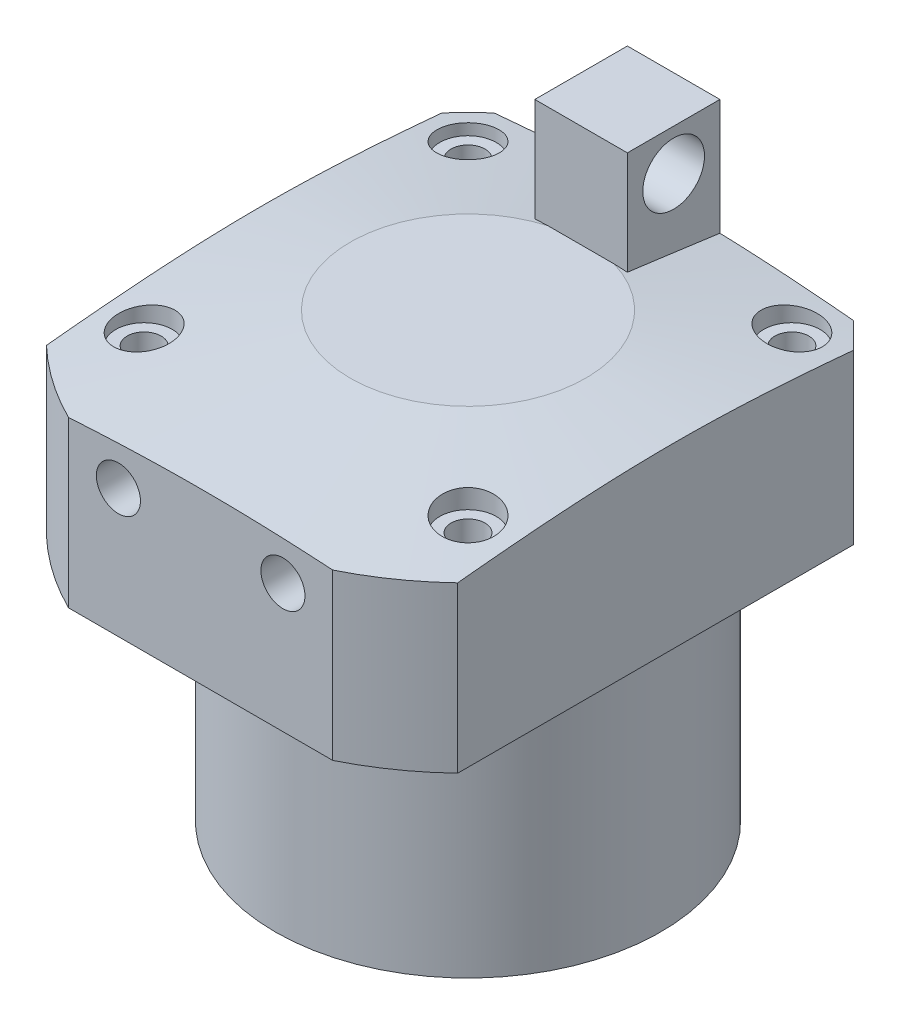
SolidWorks part; units mm, degrees
ref_plane "Front Plane" through (0, 0, 0) normal (0, 0, 1) x (1, 0, 0)
ref_plane "Top Plane" through (0, 0, 0) normal (0, 1, 0) x (1, 0, 0)
ref_plane "Right Plane" through (0, 0, 0) normal (1, 0, 0) x (0, 0, -1)
sketch "Sketch1" plane through (0, 0, 0) normal (0, 0, 1) x (1, 0, 0)
  line L0 (0, 87.0508) -> (0, 0) construction
  line L1 (0, 0) -> (-37.5, 0)
  line L2 (-37.5, 0) -> (-37.5, 49)
  line L3 (-37.5, 49) -> (-58, 49)
  line L4 (-58, 49) -> (-58, 81.0696)
  line L5 (-22.9181, 86) -> (-58, 81.0696)
  line L6 (-22.9181, 86) -> (0, 86)
  line L7 (0, 0) -> (0, 86)
  dimension "D1" = 37.5
  dimension "D2" = 49
  dimension "D3" = 58
  dimension "D4" = 8
  dimension "D5" = 37
revolve "Revolve1" add sketch "Sketch1" angle 360 about L0
sketch "Sketch2" plane through (0, 86, 0) normal (0, 1, 0) x (1, 0, 0)
  line L0 (0, 0) -> (0, 40) construction
  line L1 (-40, 40) -> (40, 40)
  line L2 (-40, 40) -> (-40, -52)
  line L3 (-40, -52) -> (40, -52)
  line L4 (40, 40) -> (40, -52)
  dimension "D1" = 92
  dimension "D2" = 80
  dimension "D3" = 40
extrude "Cut-Extrude2" cut sketch "Sketch2" against normal through all flip side to cut
chamfer "Chamfer1" distance 5 angle 45 2 edges at (40, 65.1354, -40) (-40, 65.1354, -40)
hole_wizard "G1/8 Tapped Hole1" positions "Sketch6" profile "Sketch5" tap size "G1/8" standard "ISO"
sketch "Sketch6" plane through (0, 0, 52) normal (0, 0, 1) x (1, 0, 0)
  line L0 (-16, 74) -> (16, 74) construction
  line L4 (0, 74) -> (0, 86) construction
  line L5 (-25.6905, 86) -> (25.6905, 86) construction
  point P0 (-16, 74)
  point P1 (16, 74)
  dimension "D1" = 12
  dimension "D2" = 32
sketch "Sketch5" plane through (-16, 74, 52) normal (1, 0, 0) x (0, -1, 0)
  line L0 (0, 0) -> (0, 22.18)
  line L1 (0, 22.18) -> (4.283, 22.18)
  line L2 (4.283, 22.18) -> (4.283, 0)
  line L5 (4.283, 0) -> (0, 0)
  line L10 (0, 22.18) -> (-4.283, 22.18) construction
  line L11 (0, -6.35) -> (0, 107.95) construction
  dimension "Tap Drill Dia." = 8.566
  dimension "Tap Drill Depth" = 22.18
  dimension "Drill Angle" = 180
hole_wizard "CBORE for M6 Hex Socket Head Cap Screw2" positions "Sketch10" profile "Sketch9" counterbore size "M6" standard "ISO"
sketch "Sketch10" plane through (0, 86, 0) normal (0, 1, 0) x (-1, 0, 0)
  point P1 (31.5, -31.5)
  point P4 (-31.5, -31.5)
  point P7 (-31.5, 31.5)
  point P10 (31.5, 31.5)
  dimension "D1" = 63
  dimension "D2" = 63
sketch "Sketch9" plane through (-31.5, 86, -31.5) normal (1, 0, 0) x (0, 0, 1)
  line L0 (0, 0) -> (0, 37)
  line L1 (3.3, 36.975) -> (3.325, 37)
  line L2 (3.3, 36.975) -> (3.3, 6)
  line L3 (3.3, 6) -> (5.5, 6)
  line L4 (5.5, 6) -> (5.5, 0)
  line L5 (5.5, 0) -> (0, 0)
  line L11 (0, -6.35) -> (0, 107.95) construction
  line L12 (3.325, 37) -> (0, 37)
  line L13 (-3.3, 36.975) -> (-3.325, 37) construction
  dimension "Thru Hole Dia." = 6.6
  dimension "Thru Hole Depth" = 37
  dimension "C'Bore Dia." = 11
  dimension "C'Bore Depth" = 6
  dimension "Far C'Sink Dia." = 6.65
  dimension "Far C'Sink Angle" = 90
hole_wizard "Ø8.0 (8) Diameter Hole2" positions "Sketch12" profile "Sketch11" hole size "Ø8.0" standard "ISO"
sketch "Sketch12" plane through (0, 49, 0) normal (0, -1, 0) x (1, 0, 0)
  point P0 (-16, 45)
  point P1 (16, 45)
  dimension "D1" = 45
  dimension "D2" = 16
  dimension "D3" = 16
sketch "Sketch11" plane through (-16, 49, 45) normal (1, 0, 0) x (0, 0, -1)
  line L0 (0, 0) -> (0, 1.5)
  line L1 (0, 1.5) -> (4, 1.5)
  line L2 (4, 1.5) -> (4, 0)
  line L5 (4, 0) -> (0, 0)
  line L10 (0, 1.5) -> (-4, 1.5) construction
  line L11 (0, -6.35) -> (0, 107.95) construction
  dimension "Hole Dia." = 8
  dimension "Hole Depth" = 1.5
  dimension "Drill Angle" = 180
sketch "Sketch13" plane through (0, 86, 0) normal (0, 1, 0) x (-1, 0, 0)
  line L0 (-35, -40) -> (35, -40) construction
  line L1 (9, -22) -> (-9, -22)
  line L2 (9, -22) -> (9, -40)
  line L3 (9, -40) -> (-9, -40)
  line L4 (-9, -22) -> (-9, -40)
  line L5 (9, -22) -> (-9, -40) construction
  line L6 (9, -40) -> (-9, -22) construction
  point P0 (0, -31)
  dimension "D1" = 18
  dimension "D2" = 18
extrude "Boss-Extrude1" add sketch "Sketch13" along normal blind 20 and the other way up to surface
sketch "Sketch14" plane through (-9, 0, 0) normal (-1, 0, 0) x (0, 0, 1)
  line L0 (-40, 83.4588) -> (-40, 106) construction
  line L2 (-40, 106) -> (-22, 106) construction
  circle A0 centre (-31, 98) radius 6
  dimension "D1" = 12
  dimension "D2" = 9
  dimension "D3" = 8
extrude "Cut-Extrude3" cut sketch "Sketch14" against normal blind 20
